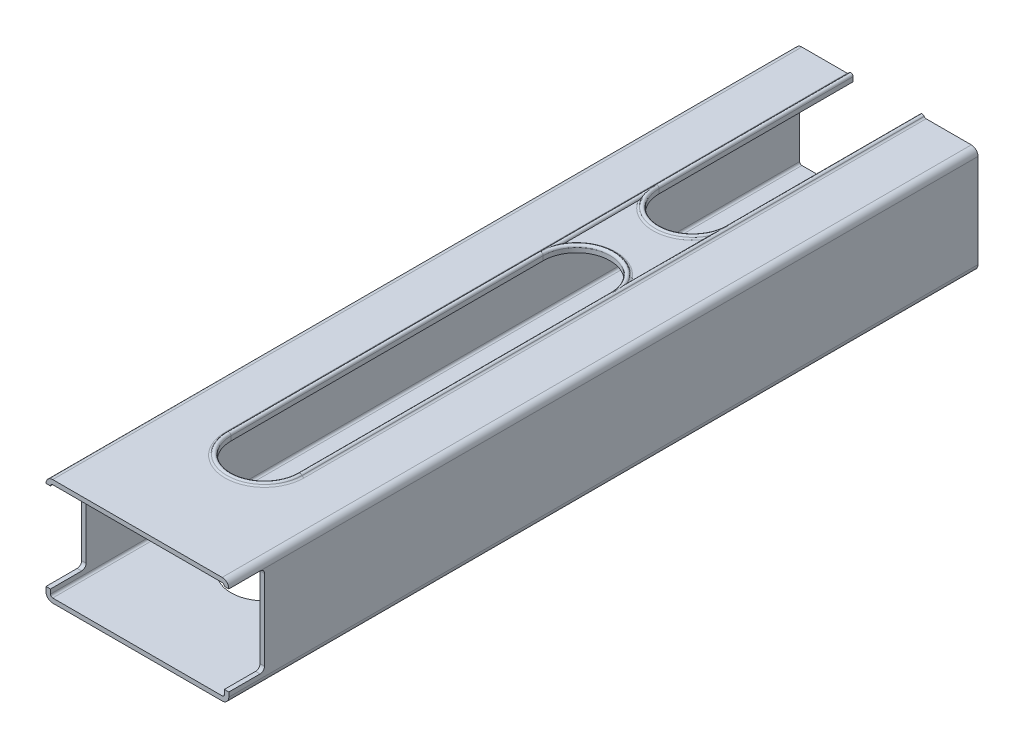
SolidWorks part; units mm, degrees
ref_plane "Face" through (0, 0, 0) normal (0, 0, 1) x (1, 0, 0)
ref_plane "Dessus" through (0, 0, 0) normal (0, 1, 0) x (1, 0, 0)
ref_plane "Droite" through (0, 0, 0) normal (1, 0, 0) x (0, 0, -1)
sketch "Esquisse1" plane through (0, 0, 0) normal (0, 0, 1) x (1, 0, 0)
  line L1 (0.5, 0) -> (38.5, 0)
  line L2 (0, 0.5) -> (0, 21.5)
  line L3 (0.5, 22) -> (38.5, 22)
  line L4 (39, 0.5) -> (39, 21.5)
  arc A0 (38.5, 0) -> (39, 0.5) centre (38.5, 0.5) ccw
  arc A1 (38.5, 22) -> (39, 21.5) centre (38.5, 21.5) cw
  arc A2 (0, 21.5) -> (0.5, 22) centre (0.5, 21.5) cw
  arc A3 (0.5, 0) -> (0, 0.5) centre (0.5, 0.5) cw
  point P8 (39, 22)
  point P11 (0, 22)
  point P14 (0, 0)
  dimension "D3" = 0.5
  dimension "D1" = 39
  dimension "D2" = 22
extrude "Extru.-Mince1" add sketch "Esquisse1" along normal blind 168 thin
sketch "Esquisse2" plane through (40, 0, 0) normal (1, 0, 0) x (0, 0, -1)
  line L0 (-168, 0.5) -> (-168, 21.5) construction
  line L1 (-168, 21.5) -> (-161, 21.5)
  line L2 (-168, 21.5) -> (-168, 1.5)
  line L3 (-168, 1.5) -> (-161, 1.5)
  line L4 (-160, 20.5) -> (-160, 2.5)
  line L5 (-168, 11.5) -> (-175.9042, 11.5) construction
  line L6 (-168, 23) -> (0, 23) construction
  line L7 (-168, -1) -> (0, -1) construction
  arc A0 (-161, 21.5) -> (-160, 20.5) centre (-161, 20.5) cw
  arc A1 (-161, 1.5) -> (-160, 2.5) centre (-161, 2.5) ccw
  point P16 (-160, 1.5)
  dimension "D4" = 1
  dimension "D1" = 1.5
  dimension "D2" = 8
  dimension "D3" = 2.5
extrude "Enlèv. mat.-Extru.1" cut sketch "Esquisse2" against normal through all
sketch "Esquisse3" plane through (17, 23, 0) normal (0, -1, 0) x (0, 0, -1)
  line L0 (0, 2.5) -> (-149.6076, 2.5) construction
  line L2 (-43.5, 26.8551) -> (-43.5, -19.9671) construction
  line L3 (-69.5, -19.9671) -> (-69.5, 26.8551) construction
  line L4 (-139.5, 26.8551) -> (-139.5, -23.7431) construction
  line L5 (0, -16.5) -> (0, 21.5) construction
  line L6 (-139.5, 10) -> (-69.5, 10)
  line L7 (-69.5, -5) -> (-139.5, -5)
  line L8 (-43.5, 10) -> (0, 10)
  line L9 (0, 10) -> (0, -5)
  line L10 (0, -5) -> (-43.5, -5)
  arc A0 (-139.5, 10) -> (-139.5, -5) centre (-139.5, 2.5) ccw
  arc A1 (-69.5, -5) -> (-69.5, 10) centre (-69.5, 2.5) ccw
  arc A2 (-43.5, 10) -> (-43.5, -5) centre (-43.5, 2.5) ccw
  dimension "D4" = 15
  dimension "D1" = 43.5
  dimension "D2" = 26
  dimension "D3" = 70
extrude "Enlèv. mat.-Extru.3" cut sketch "Esquisse3" along normal through all
sketch "Esquisse4" plane through (0, -1, 0) normal (0, -1, 0) x (1, 0, 0)
  line L0 (12, 139.5) -> (12, 69.5) construction
  line L1 (27, 69.5) -> (27, 139.5) construction
  line L2 (12, 139.5) -> (12, 69.5)
  line L3 (27, 69.5) -> (27, 139.5)
  arc A0 (27, 139.5) -> (12, 139.5) centre (19.5, 139.5) ccw construction
  arc A1 (12, 69.5) -> (27, 69.5) centre (19.5, 69.5) ccw construction
  arc A2 (27, 139.5) -> (12, 139.5) centre (19.5, 139.5) ccw
  arc A3 (12, 69.5) -> (27, 69.5) centre (19.5, 69.5) ccw
ref_plane "Plan1" through (0, 0, 69.5) normal (0, 0, -1) x (-1, 0, 0)
sketch "Esquisse5" plane through (0, 0, 69.5) normal (0, 0, -1) x (-1, 0, 0)
  line L0 (-38.5, 23) -> (-27, 23) construction
  line L1 (-27, 23) -> (-27, 22) construction
  line L2 (-28.366, 23) -> (-27, 23)
  line L3 (-39, 11) -> (-22.8908, 11) construction
  line L4 (-39, 0.5) -> (-39, 21.5) construction
  line L5 (-28.366, -1) -> (-27, -1)
  arc A0 (-27, 23) -> (-27.933, 23.25) centre (-27.5, 23) ccw
  arc A1 (-28.366, 23) -> (-27.933, 23.25) centre (-28.366, 23.5) ccw
  arc A2 (-28.366, -1) -> (-27.933, -1.25) centre (-28.366, -1.5) cw
  arc A3 (-27, -1) -> (-27.933, -1.25) centre (-27.5, -1) cw
  dimension "D1" = 1
  dimension "D2" = 1
sweep "Balayage1" add profiles "Esquisse5" path "Esquisse4"
ref_plane "Plan2" through (12, 23, 43.5) normal (0, 0, -1) x (-1, 0, 0)
sketch "Esquisse7" plane through (0, 23, 0) normal (0, 1, 0) x (-1, 0, 0)
  line L0 (-12, 43.5) -> (-12, 0) construction
  line L1 (-27, 0) -> (-27, 43.5) construction
  line L2 (-12, 43.5) -> (-12, 0)
  line L3 (-27, 0) -> (-27, 43.5)
  arc A0 (-12, 43.5) -> (-27, 43.5) centre (-19.5, 43.5) ccw construction
  arc A1 (-12, 43.5) -> (-27, 43.5) centre (-19.5, 43.5) ccw
sketch "Esquisse8" plane through (0, 0, 0) normal (0, 0, -1) x (-1, 0, 0)
  line L0 (-28.366, 23) -> (-27, 23)
  line L1 (-28.366, -1) -> (-27, -1)
  arc A0 (-28.366, 23) -> (-27.933, 23.25) centre (-28.366, 23.5) ccw construction
  arc A1 (-27, 23) -> (-27.933, 23.25) centre (-27.5, 23) ccw construction
  arc A2 (-28.366, 23) -> (-27.933, 23.25) centre (-28.366, 23.5) ccw
  arc A3 (-27, 23) -> (-27.933, 23.25) centre (-27.5, 23) ccw
  arc A4 (-27.933, -1.25) -> (-27, -1) centre (-27.5, -1) ccw construction
  arc A5 (-27.933, -1.25) -> (-28.366, -1) centre (-28.366, -1.5) ccw construction
  arc A6 (-27.933, -1.25) -> (-27, -1) centre (-27.5, -1) ccw
  arc A7 (-27.933, -1.25) -> (-28.366, -1) centre (-28.366, -1.5) ccw
sweep "Balayage2" add profiles "Esquisse8" path "Esquisse7"
sketch "Esquisse9" plane through (0, -1, 0) normal (0, -1, 0) x (1, 0, 0)
  line L0 (27, 69.5) -> (27, 43.5)
  line L1 (-7.15, 69.5) -> (7.15, 69.5) construction
  line L2 (-43, 43.5) -> (67, 43.5) construction
  arc A0 (12, 69.5) -> (27, 69.5) centre (19.5, 69.5) ccw construction
sketch "Esquisse10" plane through (12, 23, 43.5) normal (0, 0, -1) x (-1, 0, 0)
  line L0 (-16.366, 0) -> (-15, 0)
  line L1 (1.366, 0) -> (0, 0)
  line L2 (0, -24) -> (1.366, -24)
  line L3 (-16.366, -24) -> (-15, -24)
  arc A0 (-15, 0) -> (-15.933, 0.25) centre (-15.5, 0) ccw construction
  arc A1 (-16.366, 0) -> (-15.933, 0.25) centre (-16.366, 0.5) ccw construction
  arc A2 (-15, 0) -> (-15.933, 0.25) centre (-15.5, 0) ccw
  arc A3 (-16.366, 0) -> (-15.933, 0.25) centre (-16.366, 0.5) ccw
  arc A4 (0.933, 0.25) -> (1.366, 0) centre (1.366, 0.5) ccw construction
  arc A5 (0.933, 0.25) -> (0, 0) centre (0.5, 0) ccw construction
  arc A6 (0.933, 0.25) -> (1.366, 0) centre (1.366, 0.5) ccw
  arc A7 (0.933, 0.25) -> (0, 0) centre (0.5, 0) ccw
  arc A8 (1.366, -24) -> (0.933, -24.25) centre (1.366, -24.5) ccw construction
  arc A9 (0, -24) -> (0.933, -24.25) centre (0.5, -24) ccw construction
  arc A10 (1.366, -24) -> (0.933, -24.25) centre (1.366, -24.5) ccw
  arc A11 (0, -24) -> (0.933, -24.25) centre (0.5, -24) ccw
  arc A12 (-15.933, -24.25) -> (-15, -24) centre (-15.5, -24) ccw construction
  arc A13 (-15.933, -24.25) -> (-16.366, -24) centre (-16.366, -24.5) ccw construction
  arc A14 (-15.933, -24.25) -> (-15, -24) centre (-15.5, -24) ccw
  arc A15 (-15.933, -24.25) -> (-16.366, -24) centre (-16.366, -24.5) ccw
sweep "Balayage3" add profiles "Esquisse10" path "Esquisse9"
